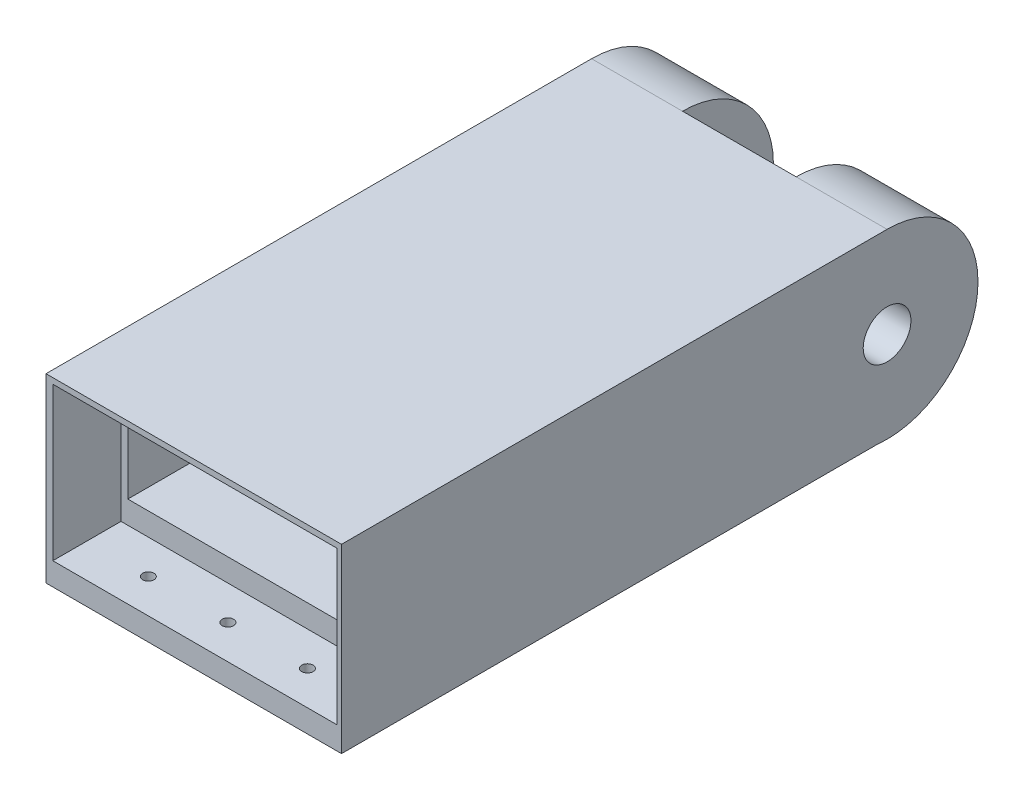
SolidWorks part; units mm, degrees
ref_plane "前视基准面" through (0, 0, 0) normal (0, 0, 1) x (1, 0, 0)
ref_plane "上视基准面" through (0, 0, 0) normal (0, 1, 0) x (1, 0, 0)
ref_plane "右视基准面" through (0, 0, 0) normal (1, 0, 0) x (0, 0, -1)
sketch "草图1" plane through (-32.3024, 0, 0) normal (1, 0, 0) x (0, 0, -1)
  line L0 (-1194.3141, 62.7507) -> (-1192.6963, 77.6632) construction
  line L1 (-1190, 142.5174) -> (-1400, 142.5174)
  line L2 (-1400, 142.5174) -> (-1400, 62.7507)
  line L3 (-1400, 62.7507) -> (-1194.3141, 62.7507)
  arc A0 (-1190, 142.5174) -> (-1194.3141, 62.7507) centre (-1190, 102.5174) cw
  dimension "D1" = 210
extrude "凸台-拉伸1" add sketch "草图1" along normal blind 40
sketch "草图2" plane through (-32.3024, 0, 0) normal (-1, 0, 0) x (0, 0, 1)
  line L0 (1194.3141, 77.8924) -> (1194.3141, 62.7507)
  line L1 (1194.3141, 62.7507) -> (1400, 62.7507)
  line L2 (1400, 62.7507) -> (1400, 142.5174)
  line L3 (1400, 142.5174) -> (1190, 142.5174)
  line L4 (1190, 142.5174) -> (1190, 127.5174)
  arc A0 (1190, 127.5174) -> (1194.3141, 77.8924) centre (1190, 102.5174) cw
  arc A1 (1192.6963, 77.6632) -> (1187.3037, 127.3716) centre (1190, 102.5174) ccw construction
extrude "凸台-拉伸2" add sketch "草图2" along normal blind 50
sketch "草图3" plane through (-82.3024, 0, 0) normal (-1, 0, 0) x (0, 0, 1)
  line L0 (1194.3141, 77.8924) -> (1194.3141, 62.7507) construction
  line L1 (1190, 142.5174) -> (1400, 142.5174)
  line L2 (1400, 142.5174) -> (1190, 142.5174) construction
  line L3 (1400, 142.5174) -> (1400, 62.7507)
  line L4 (1400, 62.7507) -> (1194.3141, 62.7507)
  arc A0 (1190, 142.5174) -> (1194.3141, 62.7507) centre (1190, 102.5174) ccw
extrude "凸台-拉伸3" add sketch "草图3" along normal blind 40
sketch "草图4" plane through (7.6976, 0, 0) normal (1, 0, 0) x (0, 0, -1)
  line L0 (-1190, 137.5174) -> (-1400, 137.5174)
  line L4 (-1190, 142.5174) -> (-1400, 142.5174) construction
  line L6 (-1190, 127.5174) -> (-1190, 137.5174)
  line L7 (-1205.3062, 82.7507) -> (-1400, 82.7507)
  line L8 (-1400, 82.7507) -> (-1400, 137.5174)
  line L9 (-1400, 62.7507) -> (-1194.3141, 62.7507) construction
  line L11 (-1400, 142.5174) -> (-1400, 62.7507) construction
  arc A0 (-1190, 127.5174) -> (-1205.3062, 82.7507) centre (-1190, 102.5174) ccw
  dimension "D4" = 25
  dimension "D1" = 10
  dimension "D2" = 5
  dimension "D3" = 0
  dimension "D5" = 20
extrude "切除-拉伸1" cut sketch "草图4" against normal offset from surface (118 mm away) 6 from offset 6
sketch "草图5" plane through (0, 62.7507, 0) normal (0, -1, 0) x (1, 0, 0)
  line L1 (-82.3024, 1194.3141) -> (-32.3024, 1194.3141)
  line L2 (-82.3024, 1194.3141) -> (-82.3024, 1234.3141)
  line L3 (-82.3024, 1234.3141) -> (-32.3024, 1234.3141)
  line L4 (-32.3024, 1194.3141) -> (-32.3024, 1234.3141)
  dimension "D1" = 40
  dimension "D2" = 50
extrude "切除-拉伸2" cut sketch "草图5" against normal up to next
sketch "草图6" plane through (0, 0, 1400) normal (0, 0, 1) x (1, 0, 0)
  line L1 (-122.3024, 142.5174) -> (7.6976, 142.5174)
  line L2 (-122.3024, 142.5174) -> (-122.3024, 62.7507)
  line L3 (-122.3024, 62.7507) -> (7.6976, 62.7507)
  line L4 (7.6976, 142.5174) -> (7.6976, 62.7507)
  line L5 (-119.3024, 140.0174) -> (5.7729, 140.0174)
  line L6 (-119.3024, 140.0174) -> (-119.3024, 72.7507)
  line L7 (-119.3024, 72.7507) -> (5.7729, 72.7507)
  line L8 (5.7729, 140.0174) -> (5.7729, 72.7507)
  dimension "D1" = 10
  dimension "D2" = 3
  dimension "D3" = 2.5
extrude "凸台-拉伸4" add sketch "草图6" along normal blind 30
sketch "草图7" plane through (0, 62.7507, 0) normal (0, -1, 0) x (1, 0, 0)
  line L0 (7.6976, 1430) -> (7.6976, 1194.3141) construction
  line L1 (-122.3024, 1194.3141) -> (-122.3024, 1430) construction
  line L2 (-122.3024, 1430) -> (7.6976, 1430) construction
  circle A0 centre (-92.3024, 1415) radius 5.5
  circle A1 centre (-57.3024, 1415) radius 5.5
  circle A2 centre (-22.3024, 1415) radius 5.5
  dimension "D1" = 11
  dimension "D2" = 11
  dimension "D3" = 11
  dimension "D4" = 65
  dimension "D5" = 30
  dimension "D6" = 30
  dimension "D7" = 15
  dimension "D8" = 15
  dimension "D9" = 15
extrude "切除-拉伸3" cut sketch "草图7" against normal blind 2.5
sketch "草图8" plane through (0, 65.2507, 0) normal (0, -1, 0) x (1, 0, 0)
  circle A0 centre (-92.3024, 1415) radius 2.5
  circle A1 centre (-57.3024, 1415) radius 2.5
  circle A2 centre (-22.3024, 1415) radius 2.5
  dimension "D1" = 5
  dimension "D2" = 5
  dimension "D3" = 5
extrude "切除-拉伸4" cut sketch "草图8" against normal up to next
sketch "草图9" plane through (-122.3024, 0, 0) normal (-1, 0, 0) x (0, 0, 1)
  circle A0 centre (1190, 102.5174) radius 10.5
  dimension "D1" = 21
extrude "切除-拉伸5" cut sketch "草图9" against normal through all and the other way through all
